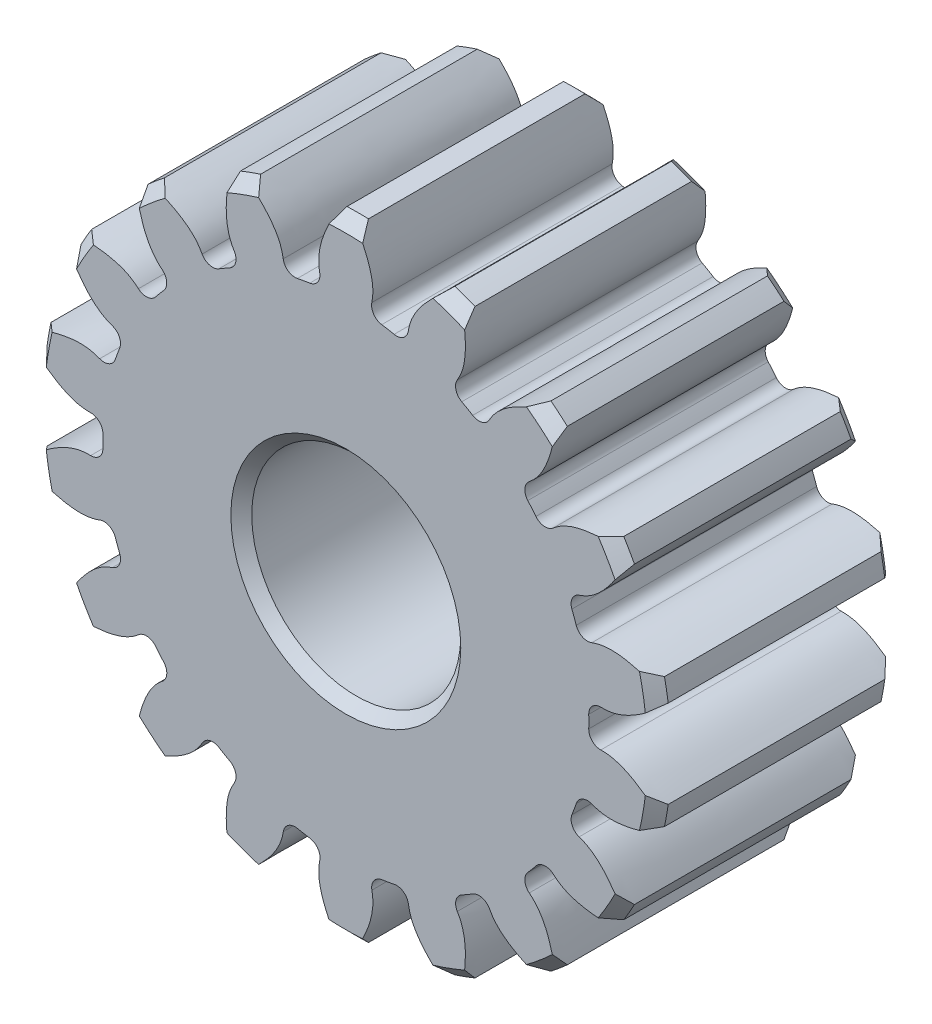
SolidWorks part; units mm, degrees
ref_plane "Plan1" through (0, 0, 0) normal (0, 0, 1) x (1, 0, 0)
ref_plane "Plan2" through (0, 0, 0) normal (0, 1, 0) x (1, 0, 0)
ref_plane "Plan3" through (0, 0, 0) normal (1, 0, 0) x (0, 0, -1)
sketch "Dent" plane through (0, 0, 0) normal (0, 0, 1) x (1, 0, 0)
  line L1 (-0.5128, 10.2479) -> (0, 8.8389)
  line L3 (0, 15) -> (0, -15) construction
  line L4 (0, 0) -> (0.5128, 14.9912) construction
  line L5 (1.1781, 13.4485) -> (-1.1781, 13.4485) construction
  line L6 (1.2953, 12.6196) -> (-1.2953, 12.6196) construction
  line L7 (-0.75, 0) -> (0.75, 0) construction
  line L9 (0.5128, 10.2479) -> (0, 8.8389)
  line L11 (0, 0) -> (1.1781, 13.4485) construction
  line L12 (0, 0) -> (1.2953, 12.6196) construction
  circle A0 centre (0, 0) radius 13.5 construction
  circle A1 centre (0, 0) radius 15 construction
  arc A2 (0.5128, 14.9912) -> (-0.5128, 14.9912) centre (0, 0) ccw
  circle A3 centre (0, 0) radius 12.6859 construction
  point P2 (-1.1781, 13.4485)
  point P3 (-1.2953, 12.6196)
  point P19 (1.1781, 13.4485)
  point P20 (1.2953, 12.6196)
sketch "Esquisse2" plane through (0, 0, 0) normal (0, 0, 1) x (1, 0, 0)
  circle A0 centre (0, 0) radius 11.625
extrude "Base-Extrusion" add sketch "Esquisse2" against normal blind 11.5
extrude "Boss.-Extru.1" add sketch "Dent" against normal blind 11.5
fillet "Congé1" radius 0.57 4 edges at (1.0666, 11.576, -5.75) (-1.0797, 11.5747, -5.75)
chamfer "Chanfrein1" distance 0.57 angle 45 4 edges at (0, 15, -11.5) (0, 15, 0)
pattern_circular "Répétition circulaire1" count 18 over 360 about axis through (0, 0, -11.5) along (0, 0, 1) of "Congé1", "Boss.-Extru.1", "Chanfrein1"
sketch "Esquisse3" plane through (0, 0, 0) normal (0, 0, 1) x (1, 0, 0)
  circle A0 centre (0, 0) radius 5
  dimension "D1" = 10
extrude "Enlèv. mat.-Extru.1" cut sketch "Esquisse3" against normal through all
chamfer "Chanfrein2" distance 0.5 angle 45 2 edges at (5, 0, -11.5) (5, 0, 0)
sketch "Esquisse4" plane through (0, 0, 0) normal (0, 0, 1) x (1, 0, 0)
  line L0 (0, 0) -> (9.4682, 0)
  line L1 (0, 0) -> (-5.0095, 8.6766)
  line L2 (0, 0) -> (-4.9351, -8.5478)
  dimension "D1" = 120
  dimension "D2" = 120
equation "\"Dp@Dent\" = \"Module@Dent\"*\"Nbr de dents@Répétition circulaire1\" "
equation "\"Dt@Dent\" = \"Module@Dent\"*(\"Nbr de dents@Répétition circulaire1\"+2)"
equation "\"Dpied@Esquisse2\" = \"Dp@Dent\"-(2.5*\"Module@Dent\")"
equation "\"Db@Dent\" = \"Dp@Dent\"*cos(\"Angle de pression@Dent\"*pi/180)"
equation "\"Ep au primitif@Dent\" =  (pi*\"Dp@Dent\"/2)/\"Nbr de dents@Répétition circulaire1\""
equation "\"D3@Dent\"=atn((Sin((sqr(((\"Dt@Dent\"/\"Db@Dent\")^2)-1))) -((sqr(((\"Dt@Dent\"/\"Db@Dent\")^2)-1)) * Cos((sqr(((\"Dt@Dent\"/\"Db@Dent\")^2)-1)))))/(Cos((sqr(((\"Dt@Dent\"/\"Db@Dent\")^2)-1))) +((sqr(((\"Dt@Dent\"/\"Db@"
equation "\"D4@Dent\"=atn((Sin((sqr(((\"Dp@Dent\"/\"Db@Dent\")^2)-1))) -((sqr(((\"Dp@Dent\"/\"Db@Dent\")^2)-1)) * Cos((sqr(((\"Dp@Dent\"/\"Db@Dent\")^2)-1)))))/(Cos((sqr(((\"Dp@Dent\"/\"Db@Dent\")^2)-1))) +((sqr(((\"Dp@Dent\"/\"Db@"
equation "\"D1@Congé1\" = \"Module@Dent\"*0.38"
equation "\"D1@Base-Extrusion\" = \"Epaisseur@Boss.-Extru.1\""
